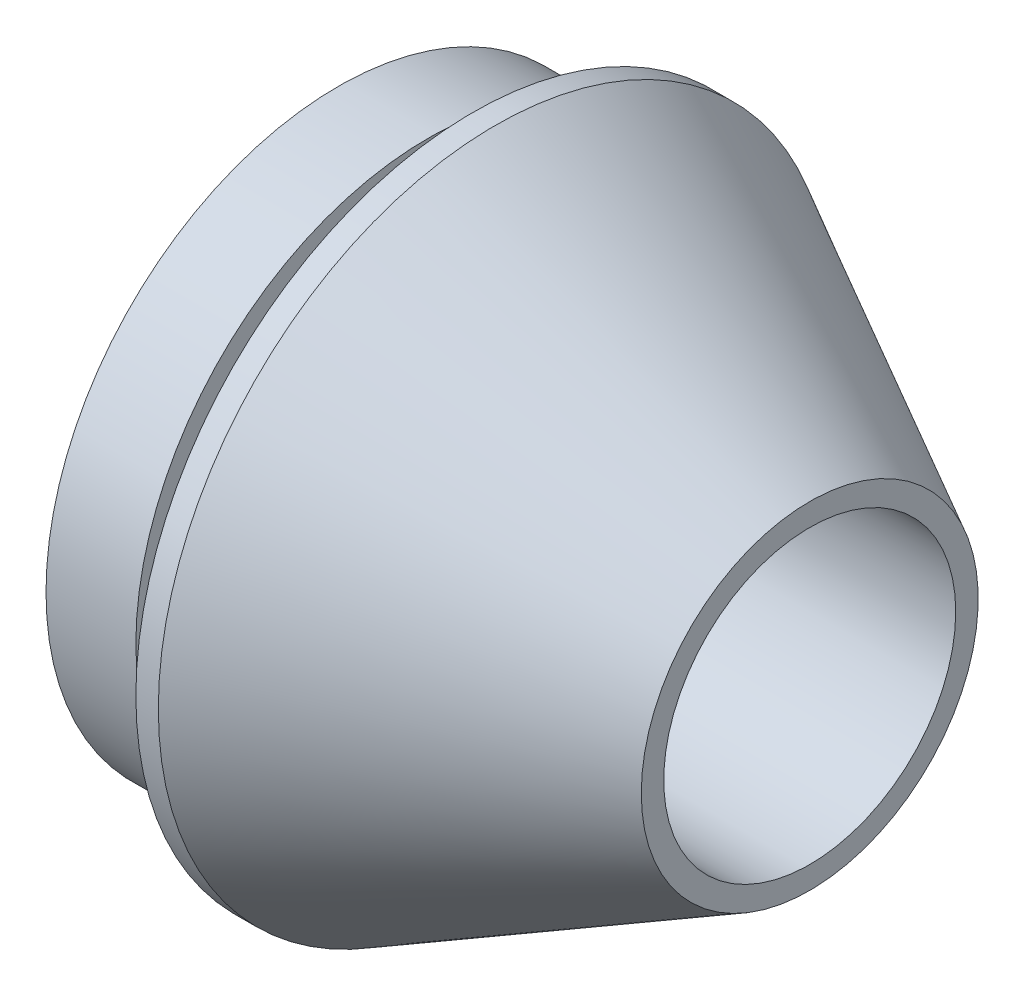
SolidWorks part; units mm, degrees
ref_plane "Front Plane" through (0, 0, 0) normal (0, 0, 1) x (1, 0, 0)
ref_plane "Top Plane" through (0, 0, 0) normal (0, 1, 0) x (1, 0, 0)
ref_plane "Right Plane" through (0, 0, 0) normal (1, 0, 0) x (0, 0, -1)
ref_plane "Plane1" through (0, 12, 0) normal (0, 1, 0) x (-1, 0, 0)
sketch "Sketch1" plane through (0, 0, 0) normal (0, 0, 1) x (1, 0, 0)
  line L0 (0, 0) -> (0, 13)
  line L1 (0, 13) -> (4, 13)
  line L2 (4, 13) -> (4, 12)
  line L3 (4, 12) -> (6, 12)
  line L4 (6, 15) -> (6, 12)
  line L5 (6, 15) -> (7, 15)
  line L6 (0, 0) -> (21, 0)
  line L7 (21, 0) -> (21, 7.5)
  line L8 (7, 15) -> (21, 7.5)
revolve "Revolve1" add sketch "Sketch1" angle 360 about L6
sketch "Sketch2" plane through (21, 0, 0) normal (1, 0, 0) x (0, 0, -1)
  circle A0 centre (0, 0) radius 6.5
extrude "Cut-Extrude1" cut sketch "Sketch2" against normal blind 21
